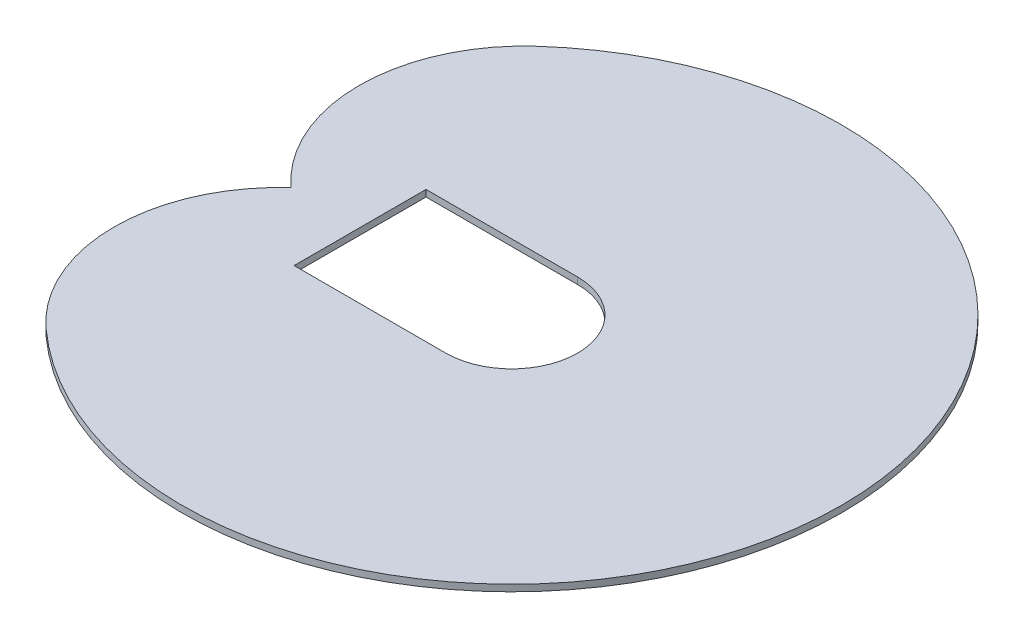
SolidWorks part; units mm, degrees
ref_plane "前视基准面" through (0, 0, 0) normal (0, 0, 1) x (1, 0, 0)
ref_plane "上视基准面" through (0, 0, 0) normal (0, 1, 0) x (1, 0, 0)
ref_plane "右视基准面" through (0, 0, 0) normal (1, 0, 0) x (0, 0, -1)
sketch "草图1" plane through (0, 0, 0) normal (0, 1, 0) x (1, 0, 0)
  line L0 (0, 0) -> (-167.2827, 185.7862) construction
  line L1 (0, 0) -> (-167.2827, -185.7862) construction
  line L2 (0, 0) -> (914.2933, 0) construction
  line L3 (-167.2827, 185.7862) -> (-635.3738, 705.6541) construction
  line L4 (0, 100) -> (-230, 100)
  line L5 (0, 100) -> (0, -100) construction
  line L6 (0, -100) -> (-230, -100)
  line L7 (-230, 100) -> (-230, -100)
  line L8 (-167.2827, 185.7862) -> (-209.5345, -620.4277) construction
  circle A0 centre (0, 0) radius 250 construction
  arc A1 (-334.5653, 371.5724) -> (-334.5653, 0) centre (-167.2827, 185.7862) ccw
  arc A2 (-334.5653, 0) -> (-334.5653, -371.5724) centre (-167.2827, -185.7862) ccw
  arc A3 (-334.5653, -371.5724) -> (-334.5653, 371.5724) centre (0, 0) ccw
  arc A4 (0, -100) -> (0, 100) centre (0, 0) ccw
  point P3 (-324.4256, -448.2689)
  point P16 (-326.6324, -490.3774)
  point P17 (914.2933, 0)
  dimension "D1" = 500
  dimension "D4" = 500
  dimension "D7" = 500
  dimension "D10" = 1000
  dimension "D5" = 200
  dimension "D2" = 132
  dimension "D3" = 132
  dimension "D6" = 230
  dimension "D8" = 135
extrude "凸台-拉伸1" add sketch "草图1" along normal blind 10
